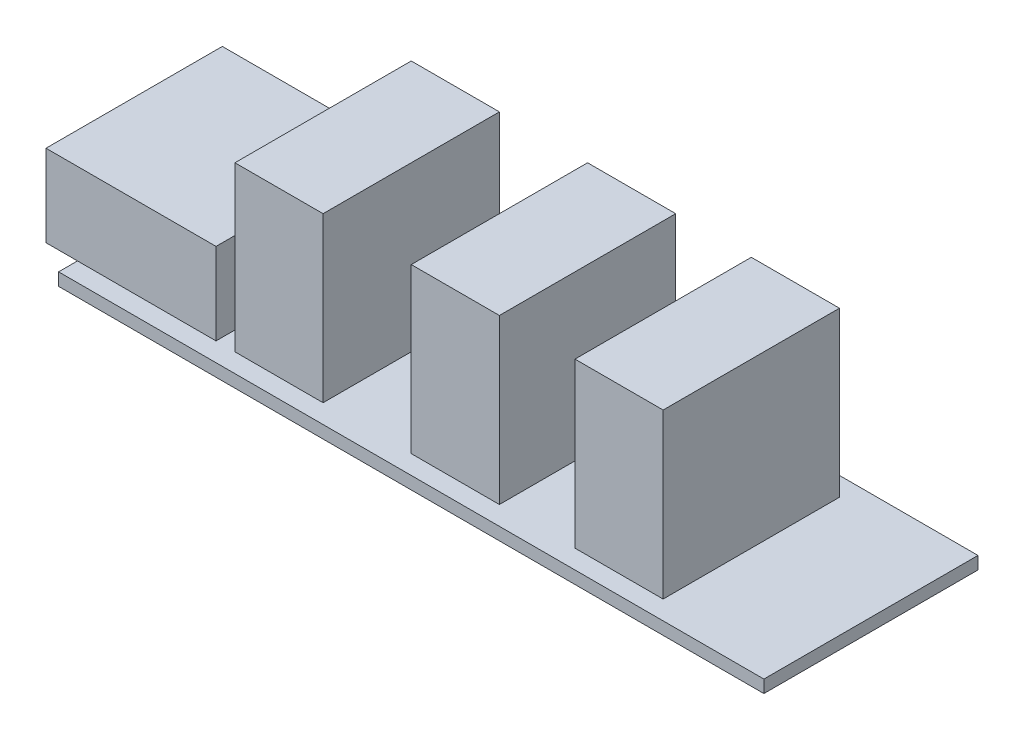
SolidWorks part; units mm, degrees
ref_plane "Front Plane" through (0, 0, 0) normal (0, 0, 1) x (1, 0, 0)
ref_plane "Top Plane" through (0, 0, 0) normal (0, 1, 0) x (1, 0, 0)
ref_plane "Right Plane" through (0, 0, 0) normal (1, 0, 0) x (0, 0, -1)
sketch "Sketch1" plane through (0, 0, 0) normal (0, 1, 0) x (1, 0, 0)
  line L1 (0, 0) -> (56, 0)
  line L2 (0, 0) -> (0, 17)
  line L3 (0, 17) -> (56, 17)
  line L4 (56, 0) -> (56, 17)
  dimension "D1" = 56
  dimension "D2" = 17
extrude "Boss-Extrude1" add sketch "Sketch1" along normal blind 1
sketch "Sketch2" plane through (0, 1, 0) normal (0, 1, 0) x (1, 0, 0)
  line L0 (56, 8.5) -> (0, 8.5) construction
  line L1 (56, 0) -> (56, 17) construction
  line L2 (0, 17) -> (0, 0) construction
  line L4 (11, 1.5) -> (-2.5, 1.5)
  line L5 (11, 1.5) -> (11, 15.5)
  line L6 (11, 15.5) -> (-2.5, 15.5)
  line L7 (-2.5, 1.5) -> (-2.5, 15.5)
  line L8 (11, 1.5) -> (-2.5, 15.5) construction
  line L9 (11, 15.5) -> (-2.5, 1.5) construction
  point P6 (4.25, 8.5)
  dimension "D1" = 13.5
  dimension "D2" = 14
  dimension "D3" = 2.5
extrude "Boss-Extrude2" add sketch "Sketch2" along normal blind 6.5
sketch "Sketch3" plane through (0, 1, 0) normal (0, 1, 0) x (1, 0, 0)
  line L0 (56, 8.5) -> (11, 8.5) construction
  line L1 (56, 0) -> (56, 17) construction
  line L2 (11, 1.5) -> (11, 15.5) construction
  line L4 (19.5, 1.5) -> (12.5, 1.5)
  line L5 (19.5, 1.5) -> (19.5, 15.5)
  line L6 (19.5, 15.5) -> (12.5, 15.5)
  line L7 (12.5, 1.5) -> (12.5, 15.5)
  line L8 (19.5, 1.5) -> (12.5, 15.5) construction
  line L9 (19.5, 15.5) -> (12.5, 1.5) construction
  line L10 (-2.5, 15.5) -> (-2.5, 1.5) construction
  line L11 (11, 15.5) -> (-2.5, 15.5) construction
  line L12 (33.5, 1.5) -> (26.5, 1.5)
  line L13 (33.5, 1.5) -> (33.5, 15.5)
  line L14 (33.5, 15.5) -> (26.5, 15.5)
  line L15 (26.5, 1.5) -> (26.5, 15.5)
  line L16 (33.5, 1.5) -> (26.5, 15.5) construction
  line L17 (33.5, 15.5) -> (26.5, 1.5) construction
  line L18 (46.5, 1.5) -> (39.5, 1.5)
  line L19 (46.5, 1.5) -> (46.5, 15.5)
  line L20 (46.5, 15.5) -> (39.5, 15.5)
  line L21 (39.5, 1.5) -> (39.5, 15.5)
  line L22 (46.5, 1.5) -> (39.5, 15.5) construction
  line L23 (46.5, 15.5) -> (39.5, 1.5) construction
  point P6 (16, 8.5)
  point P13 (30, 8.5)
  point P18 (43, 8.5)
  dimension "D1" = 15
  dimension "D2" = 7
  dimension "D3" = 7
  dimension "D4" = 6
extrude "Boss-Extrude3" add sketch "Sketch3" along normal blind 13
